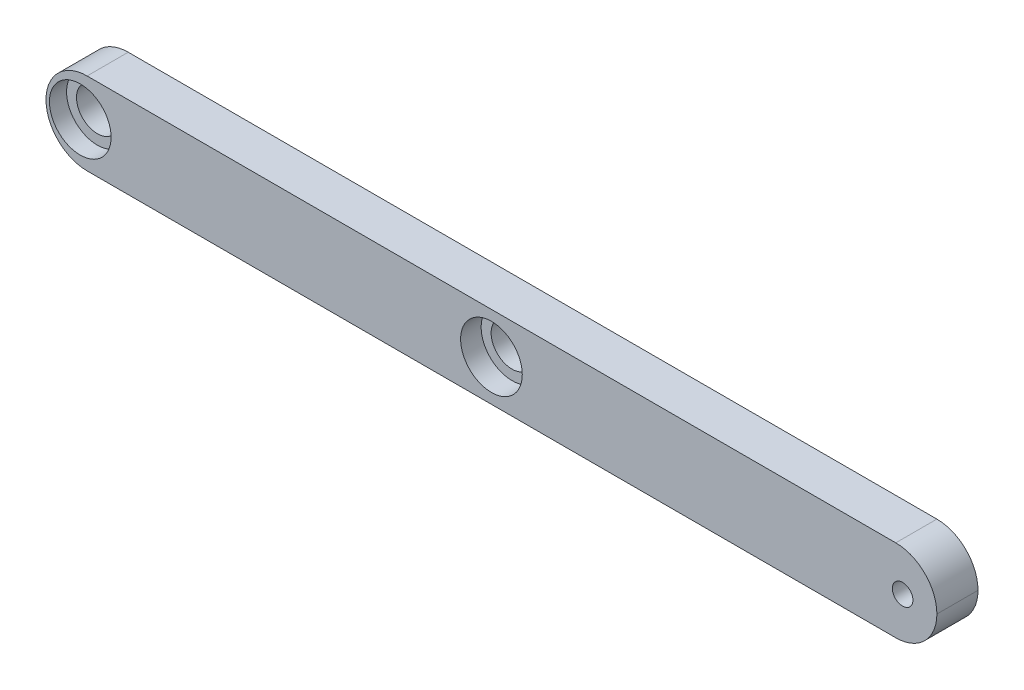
SolidWorks part; units mm, degrees
ref_plane "Face" through (0, 0, 0) normal (0, 0, 1) x (1, 0, 0)
ref_plane "Dessus" through (0, 0, 0) normal (0, 1, 0) x (1, 0, 0)
ref_plane "Droite" through (0, 0, 0) normal (1, 0, 0) x (0, 0, -1)
sketch "Esquisse1" plane through (0, 0, 0) normal (0, 0, 1) x (1, 0, 0)
  line L1 (-69.639, 12.2396) -> (60.361, 12.2396)
  line L2 (-69.639, 12.2396) -> (-69.639, 0.2396)
  line L3 (-69.639, 0.2396) -> (60.361, 0.2396)
  line L4 (60.361, 12.2396) -> (60.361, 0.2396)
  dimension "D1" = 130
  dimension "D2" = 12
extrude "Base-Extrusion" add sketch "Esquisse1" along normal blind 6
sketch "Esquisse2" plane through (0, 0, 6) normal (0, 0, 1) x (1, 0, 0)
  line L0 (60.361, 12.2396) -> (-69.639, 12.2396) construction
  line L2 (60.361, 0.2396) -> (60.361, 12.2396) construction
  circle A0 centre (55.361, 6.2396) radius 1.5
  circle A1 centre (-64.639, 6.2396) radius 3.05
  circle A2 centre (-4.639, 6.2396) radius 3.05
  dimension "D1" = 3
  dimension "D4" = 6
  dimension "D6" = 6
  dimension "D8" = 6.1
  dimension "D9" = 6.1
  dimension "D2" = 6
  dimension "D3" = 5
  dimension "D5" = 60
  dimension "D7" = 60
extrude "Enlèv. mat.-Extru.1" cut sketch "Esquisse2" against normal up to vertex
fillet "Congé1" radius 6 8 edges at (60.361, 6.2396, 6) (-69.639, 6.2396, 6) (60.361, 6.2396, 0) (-69.639, 6.2396, 0) (-69.639, 12.2396, 3) (60.361, 12.2396, 3) (60.361, 0.2396, 3) (-69.639, 0.2396, 3)
sketch "Esquisse3" plane through (0, 0, 6) normal (0, 0, 1) x (1, 0, 0)
  line L0 (54.361, 12.2396) -> (-63.639, 12.2396) construction
  circle A1 centre (-4.639, 6.2396) radius 4.5
  dimension "D1" = 6
  dimension "D2" = 65
extrude "Enlèv. mat.-Extru.2" cut sketch "Esquisse3" against normal blind 3
sketch "Esquisse4" plane through (0, 0, 6) normal (0, 0, 1) x (1, 0, 0)
  line L0 (54.361, 12.2396) -> (-63.639, 12.2396) construction
  circle A0 centre (-64.639, 6.2396) radius 4.5
  dimension "D1" = 6
  dimension "D2" = 5
extrude "Enlèv. mat.-Extru.3" cut sketch "Esquisse4" against normal blind 2.5
